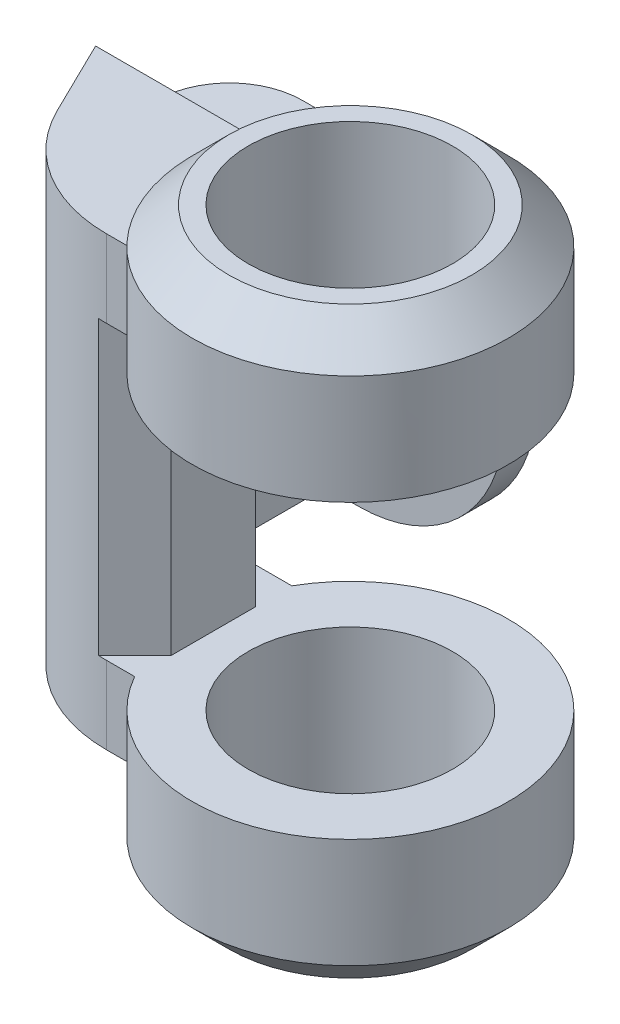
SolidWorks part; units mm, degrees
ref_plane "Front Plane" through (0, 0, 0) normal (0, 0, 1) x (1, 0, 0)
ref_plane "Top Plane" through (0, 0, 0) normal (0, 1, 0) x (1, 0, 0)
ref_plane "Right Plane" through (0, 0, 0) normal (1, 0, 0) x (0, 0, -1)
sketch "Sketch1" plane through (0, 0, 0) normal (0, 1, 0) x (1, 0, 0)
  circle A0 centre (0, 0) radius 7
  circle A1 centre (0, 0) radius 10.831
extrude "Boss-Extrude1" add sketch "Sketch1" along normal blind 40
sketch "Sketch2" plane through (0, 40, 0) normal (0, 1, 0) x (1, 0, 0)
  line L0 (0, 10.831) -> (0, -10.831)
  circle A0 centre (0, 0) radius 10.831 construction
ref_plane "Plane1" through (0, 0, 0) normal (-1, 0, 0) x (0, 0, 1)
sketch "Sketch3" plane through (0, 0, 0) normal (-1, 0, 0) x (0, 0, 1)
  line L0 (0, 40) -> (0, 0)
  line L1 (-10.831, 40) -> (10.831, 40) construction
  line L2 (-10.831, 0) -> (10.831, 0) construction
  line L4 (-5.3851, 4.6865) -> (5.3851, 4.6865)
  line L5 (-5.3851, 4.6865) -> (-5.3851, 35.3135)
  line L6 (-5.3851, 35.3135) -> (5.3851, 35.3135)
  line L7 (5.3851, 4.6865) -> (5.3851, 35.3135)
  line L8 (-5.3851, 4.6865) -> (5.3851, 35.3135) construction
  line L9 (-5.3851, 35.3135) -> (5.3851, 4.6865) construction
  point P6 (0, 20)
extrude "Boss-Extrude2" add sketch "Sketch3" along normal blind 40 contours L4 L7 L6 L0 | L6 L5 L4 L0
sketch "Sketch4" plane through (0, 0, 0) normal (0, -1, 0) x (1, 0, 0)
  circle A0 centre (0, 0) radius 7
extrude "Cut-Extrude1" cut sketch "Sketch4" against normal blind 40
ref_plane "Plane2" through (0, 0, 15.3851) normal (0, 0, 1) x (1, 0, 0)
sketch "Sketch5" plane through (0, 0, 15.3851) normal (0, 0, 1) x (1, 0, 0)
  line L0 (-40, 20) -> (32.918, 20)
  line L1 (-40, 4.6865) -> (-40, 35.3135) construction
  line L2 (10.831, 20) -> (10.831, 30)
  line L3 (10.831, 0) -> (10.831, 40) construction
  line L4 (-9.3973, 4.6865) -> (-9.3973, 35.3135) construction
  line L5 (31.0592, 10) -> (-9.3973, 10)
  line L6 (31.0592, 10) -> (31.0592, 30)
  line L7 (31.0592, 30) -> (-9.3973, 30)
  line L8 (-9.3973, 10) -> (-9.3973, 30)
  line L9 (31.0592, 10) -> (-9.3973, 30) construction
  line L10 (31.0592, 30) -> (-9.3973, 10) construction
extrude "Cut-Extrude2" cut sketch "Sketch5" against normal blind 40 contours L6 L7 L2 L0 | L8 L0 L2 L7 | L8 L5 L6 L0
chamfer "Chamfer1" distance 2.5 angle 45 2 edges at (-9.3973, 20, -5.3851) (-9.3973, 20, 5.3851)
chamfer "Chamfer2" distance 2.5 angle 45 2 edges at (0, 0, 10.831) (0, 40, 10.831)
sketch "Sketch6" plane through (0, 0, -5.3851) normal (0, 0, -1) x (-1, 0, 0)
  line L1 (14.0653, 10) -> (22.8442, 10)
  line L2 (14.0653, 10) -> (14.0653, 30)
  line L3 (14.0653, 30) -> (22.8442, 30)
  line L4 (22.8442, 10) -> (22.8442, 30)
  line L5 (14.0653, 10) -> (22.8442, 30) construction
  line L6 (14.0653, 30) -> (22.8442, 10) construction
  point P0 (18.4547, 20)
extrude "Boss-Extrude3" add sketch "Sketch6" along normal blind 7
sketch "Sketch7" plane through (0, 35.3135, 0) normal (0, 1, 0) x (1, 0, 0)
  line L0 (-22.8442, 5.3851) -> (-17.5764, -5.3851)
  line L1 (-40, -5.3851) -> (-9.3973, -5.3851) construction
  line L2 (-17.5764, -5.3851) -> (-40, -5.3851)
  line L3 (-40, -5.3851) -> (-40, 5.3851)
  line L4 (-40, 5.3851) -> (-22.8442, 5.3851)
extrude "Cut-Extrude3" cut sketch "Sketch7" against normal blind 34
fillet "Fillet1" radius 10 1 edges at (-17.5764, 20, 5.3851)
sketch "Sketch8" plane through (0, 30, 0) normal (0, 1, 0) x (1, 0, 0)
  line L0 (-14.0653, 12.3851) -> (3.0934, 12.3851)
  line L1 (3.0934, 12.3851) -> (3.0934, 14.5587)
  line L2 (-14.0653, 12.3851) -> (-22.8442, 12.3851)
  line L3 (-22.8442, 12.3851) -> (-22.8442, 14.5587)
  line L4 (-22.8442, 14.5587) -> (3.0934, 14.5587)
extrude "Boss-Extrude4" add sketch "Sketch8" against normal blind 20
sketch "Sketch9" plane through (0, 0, -14.5587) normal (0, 0, -1) x (-1, 0, 0)
  circle A0 centre (11.8492, 20) radius 7.8
extrude "Boss-Extrude5" add sketch "Sketch9" along normal blind 2
sketch "Sketch10" plane through (0, 0, -14.5587) normal (0, 0, -1) x (-1, 0, 0)
  line L0 (11.8973, 30) -> (-3.0934, 30)
  line L1 (-3.0934, 30) -> (-3.0934, 10)
  line L2 (9.3973, 10) -> (-10.831, 10) construction
  line L3 (-3.0934, 10) -> (22.8442, 10) construction
  line L4 (-3.0934, 10) -> (11.8973, 10)
  circle A0 centre (11.8492, 20) radius 10
extrude "Cut-Extrude4" cut sketch "Sketch10" against normal blind 4 contours A0 L0 M3 M4
fillet "Fillet2" radius 5 1 edges at (-22.8442, 20, -14.5587)
